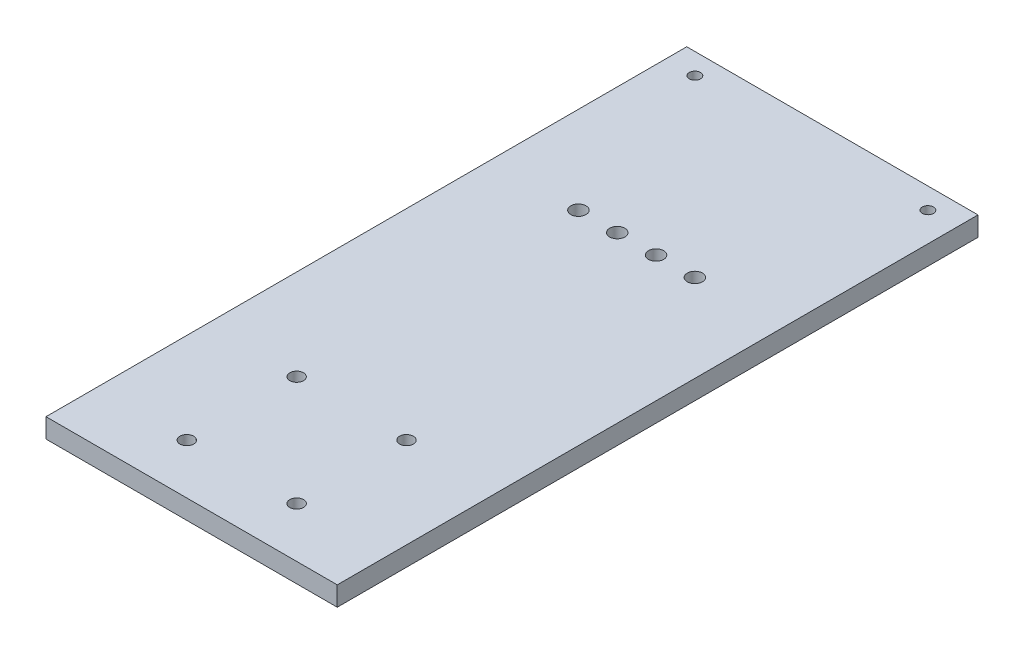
SolidWorks part; units mm, degrees
ref_plane "Front Plane" through (0, 0, 0) normal (0, 0, 1) x (1, 0, 0)
ref_plane "Top Plane" through (0, 0, 0) normal (0, 1, 0) x (1, 0, 0)
ref_plane "Right Plane" through (0, 0, 0) normal (1, 0, 0) x (0, 0, -1)
body saved out of another part "Stock-CDRCarriage-1"
